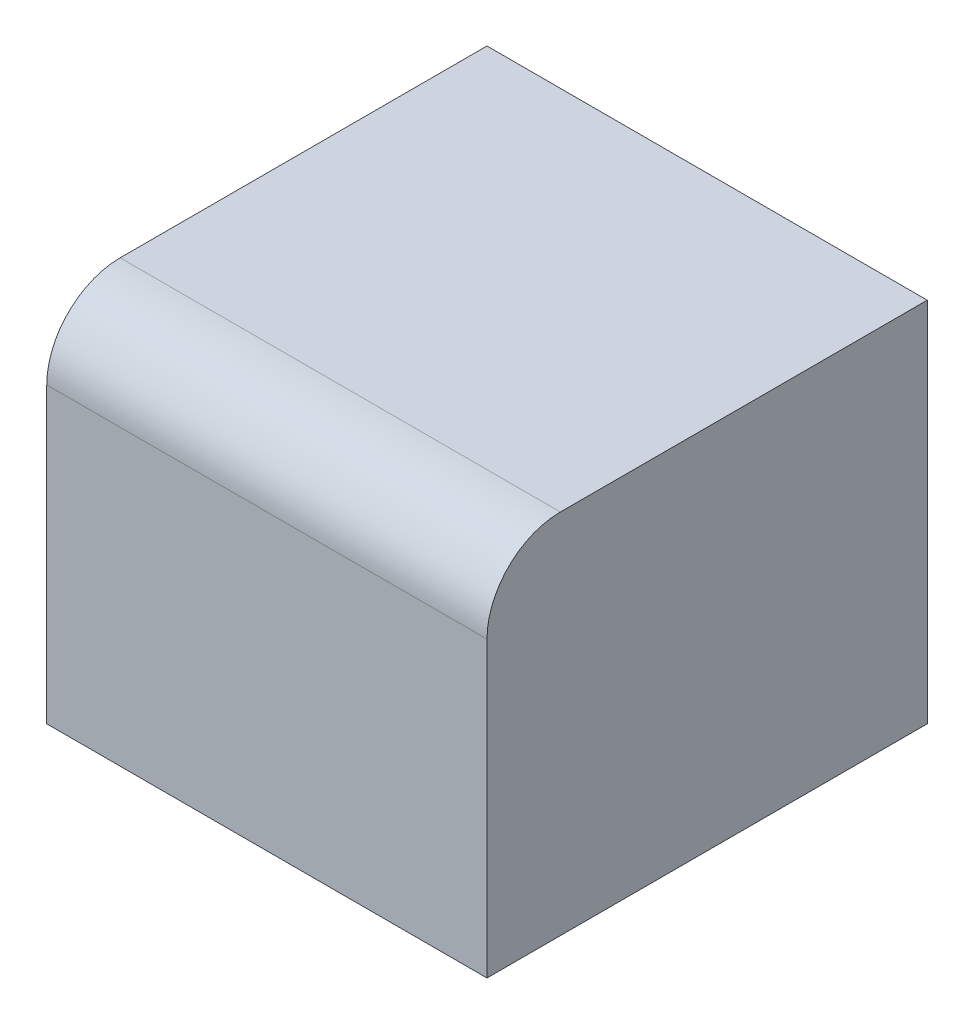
SolidWorks part; units mm, degrees
ref_plane "Front Plane" through (0, 0, 0) normal (0, 0, 1) x (1, 0, 0)
ref_plane "Top Plane" through (0, 0, 0) normal (0, 1, 0) x (1, 0, 0)
ref_plane "Right Plane" through (0, 0, 0) normal (1, 0, 0) x (0, 0, -1)
sketch "Sketch1" plane through (0, 0, 0) normal (0, 1, 0) x (1, 0, 0)
  line L1 (-30, -30) -> (30, -30)
  line L2 (-30, -30) -> (-30, 30)
  line L3 (-30, 30) -> (30, 30)
  line L4 (30, -30) -> (30, 30)
  line L5 (-30, -30) -> (30, 30) construction
  line L6 (-30, 30) -> (30, -30) construction
  point P0 (0, 0)
  dimension "D1" = 60
  dimension "D2" = 60
extrude "Boss-Extrude1" add sketch "Sketch1" along normal blind 50
fillet "Fillet1" radius 10 1 edges at (0, 50, 30)
